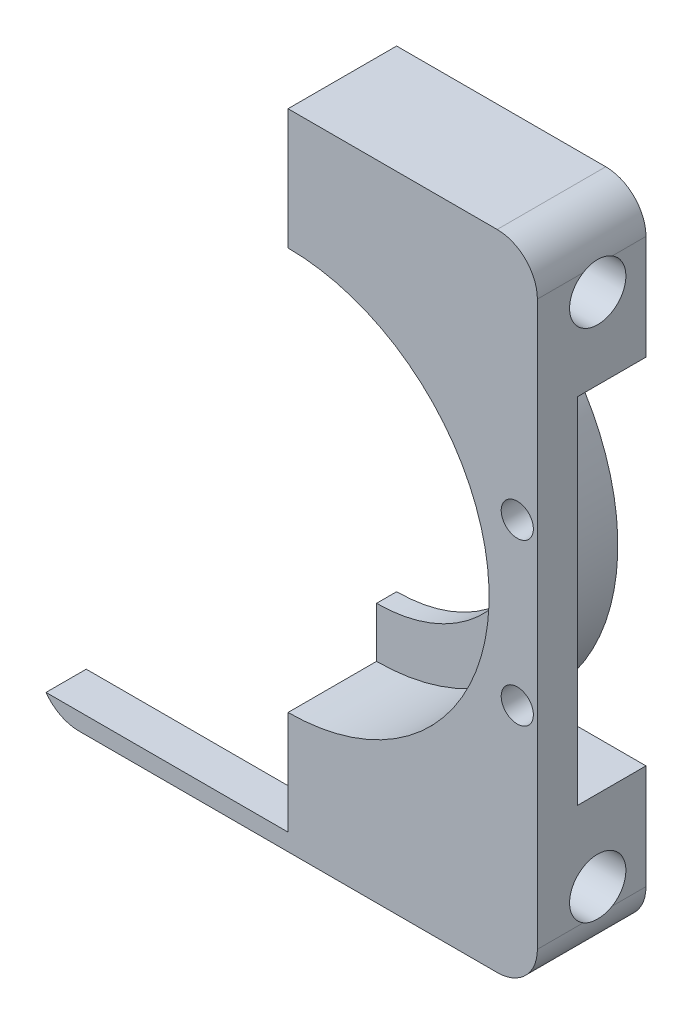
SolidWorks part; units mm, degrees
ref_plane "Front Plane" through (0, 0, 0) normal (0, 0, 1) x (1, 0, 0)
ref_plane "Top Plane" through (0, 0, 0) normal (0, 1, 0) x (1, 0, 0)
ref_plane "Right Plane" through (0, 0, 0) normal (1, 0, 0) x (0, 0, -1)
sketch "Sketch1" plane through (0, 0, 382.5) normal (0, 0, -1) x (-1, 0, 0)
  line L1 (-52, 454.7139) -> (52, 454.7139)
  line L2 (-62, 444.7139) -> (-62, 304.7139)
  line L3 (-52, 294.7139) -> (52, 294.7139)
  line L4 (62, 444.7139) -> (62, 304.7139)
  arc A0 (52, 454.7139) -> (62, 444.7139) centre (52, 444.7139) cw
  arc A1 (62, 304.7139) -> (52, 294.7139) centre (52, 304.7139) cw
  arc A2 (-52, 294.7139) -> (-62, 304.7139) centre (-52, 304.7139) cw
  arc A3 (-62, 444.7139) -> (-52, 454.7139) centre (-52, 444.7139) cw
  circle A4 centre (-57, 394.7139) radius 4
  circle A5 centre (-57, 354.7139) radius 4
  dimension "D5" = 10
  dimension "D6" = 8
  dimension "D7" = 8
  dimension "D1" = 80
  dimension "D2" = 124
  dimension "D3" = 160
  dimension "D4" = 62
  dimension "D8" = 20
  dimension "D9" = 20
  dimension "D10" = 57
  dimension "D11" = 57
extrude "Boss-Extrude1" add sketch "Sketch1" along normal blind 10
sketch "Sketch2" plane through (0, 0, 372.5) normal (0, 0, -1) x (-1, 0, 0)
  circle A0 centre (0, 374.7139) radius 50
  circle A1 centre (0, 374.7139) radius 55
  dimension "D1" = 100
  dimension "D2" = 110
extrude "Boss-Extrude2" add sketch "Sketch2" along normal blind 12
sketch "Sketch3" plane through (0, 0, 360.5) normal (0, 0, -1) x (-1, 0, 0)
  circle A0 centre (0, 374.7139) radius 55
  circle A1 centre (0, 374.7139) radius 37.5
  dimension "D1" = 110
  dimension "D2" = 75
extrude "Boss-Extrude3" add sketch "Sketch3" along normal blind 5
ref_plane "Plane1" through (0, 0, 0) normal (-1, 0, 0) x (0, 0, 1)
sketch "Sketch4" plane through (0, 0, 0) normal (-1, 0, 0) x (0, 0, 1)
  line L1 (408.4438, 456.3208) -> (338.9296, 456.3208)
  line L2 (408.4438, 456.3208) -> (408.4438, 298.9484)
  line L3 (408.4438, 298.9484) -> (338.9296, 298.9484)
  line L4 (338.9296, 456.3208) -> (338.9296, 298.9484)
extrude "Cut-Extrude1" cut sketch "Sketch4" along normal through all
sketch "Sketch5" plane through (0, 0, 372.5) normal (0, 0, -1) x (-1, 0, 0)
  line L1 (-62, 330.7139) -> (-33, 330.7139)
  line L2 (-62, 444.7139) -> (-62, 304.7139) construction
  line L3 (-62, 304.7139) -> (-62, 330.7139)
  line L4 (0, 319.7139) -> (0, 294.7139)
  line L5 (-52, 294.7139) -> (52, 294.7139) construction
  line L6 (-52, 294.7139) -> (0, 294.7139)
  line L7 (-52, 294.7139) -> (52, 294.7139) construction
  arc A1 (0, 429.7139) -> (0, 319.7139) centre (0, 374.7139) ccw construction
  arc A3 (-33, 330.7139) -> (0, 319.7139) centre (0, 374.7139) ccw
  arc A4 (-62, 304.7139) -> (-52, 294.7139) centre (-52, 304.7139) ccw construction
  arc A5 (-62, 304.7139) -> (-52, 294.7139) centre (-52, 304.7139) ccw
  dimension "D1" = 29
extrude "Boss-Extrude4" add sketch "Sketch5" along normal blind 17
ref_plane "Plane2" through (0, 374.7139, 0) normal (0, 1, 0) x (1, 0, 0)
mirror "Mirror1" about plane through (0, 374.7139, 0) normal (0, 1, 0) of "Boss-Extrude4"
sketch "Sketch7" plane through (0, 0, 0) normal (-1, 0, 0) x (0, 0, 1)
  line L0 (355.5, 454.7139) -> (382.5, 454.7139) construction
  line L1 (355.5, 454.7139) -> (355.5, 412.2139) construction
  line L2 (408.983, 374.7139) -> (341.514, 374.7139) construction
  line L3 (382.5, 374.7139) -> (405.5, 374.7139) construction
  line L4 (355.5, 374.7139) -> (372.5, 374.7139) construction
  line L5 (355.5, 374.7139) -> (91.5, 374.7139) construction
  circle A0 centre (367.5, 438.7139) radius 7
  circle A1 centre (367.5, 310.7139) radius 7
  dimension "D1" = 14
  dimension "D2" = 16
  dimension "D3" = 12
extrude "Cut-Extrude2" cut sketch "Sketch7" against normal through all
sketch "Sketch10" plane through (0, 0, 372.5) normal (0, 0, -1) x (-1, 0, 0)
  line L0 (0, 324.7139) -> (0, 424.7139) construction
  line L1 (0, 324.7139) -> (0, 424.7139)
  arc A0 (0, 424.7139) -> (0, 324.7139) centre (0, 374.7139) ccw construction
  arc A1 (0, 424.7139) -> (0, 324.7139) centre (0, 374.7139) ccw
extrude "Cut-Extrude3" cut sketch "Sketch10" against normal through all
